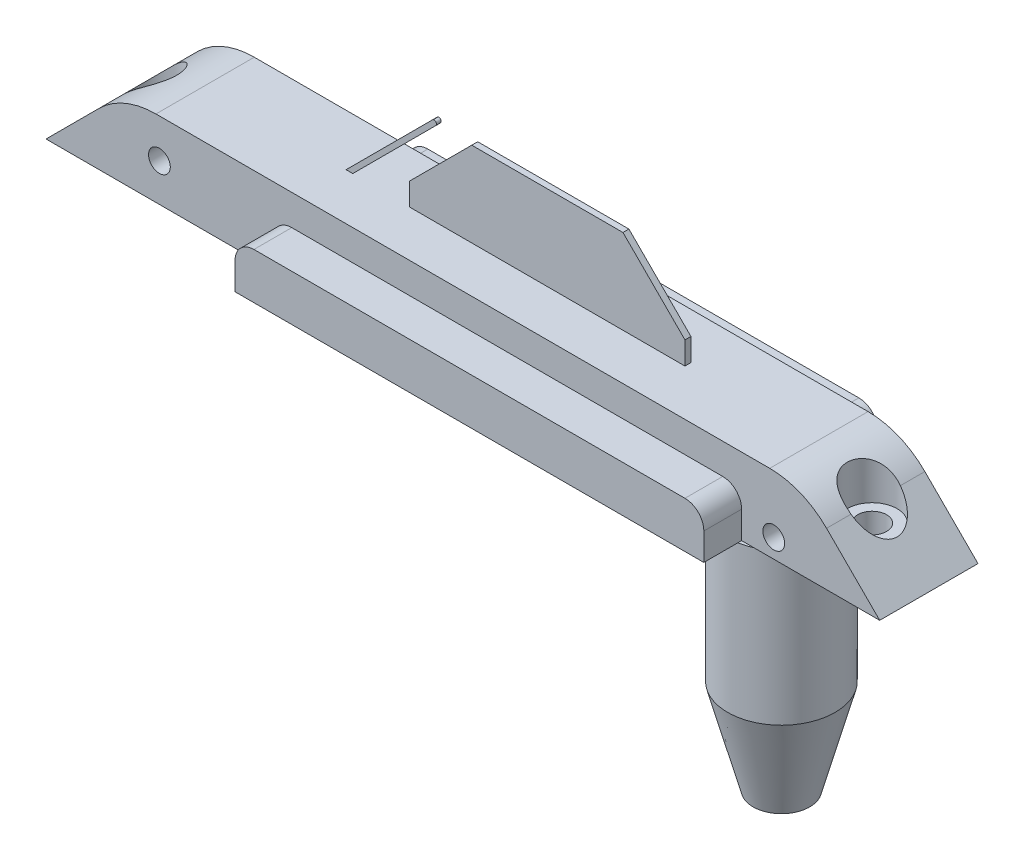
SolidWorks part; units mm, degrees
ref_plane "Front" through (0, 0, 0) normal (0, 0, 1) x (1, 0, 0)
ref_plane "Top" through (0, 0, 0) normal (0, 1, 0) x (1, 0, 0)
ref_plane "Right" through (0, 0, 0) normal (1, 0, 0) x (0, 0, -1)
sketch "Sketch1" plane through (0, 0, 0) normal (0, 1, 0) x (1, 0, 0)
  line L0 (24.765, 0) -> (0, 0) construction
  line L1 (-115.2652, 8.255) -> (24.765, 8.255)
  line L2 (-115.2652, 8.255) -> (-115.2652, -8.255)
  line L3 (-115.2652, -8.255) -> (24.765, -8.255)
  line L4 (24.765, 8.255) -> (24.765, -8.255)
  dimension "D1" = 16.51
  dimension "D2" = 140.0302
  dimension "D3" = 24.765
extrude "Extrude1" add sketch "Sketch1" along normal blind 12.8778
sketch "Sketch2" plane through (0, 0, 0) normal (0, 0, 1) x (1, 0, 0)
  line L0 (-72.7202, 12.8778) -> (-72.1589, 12.3165)
  line L1 (24.765, 12.8778) -> (-115.2652, 12.8778) construction
  line L2 (-58.2156, 27.3824) -> (-72.7202, 12.8778)
  line L7 (-57.6543, 26.8212) -> (-72.1589, 12.3165)
  arc A0 (-58.2156, 27.3824) -> (-57.6543, 26.8212) centre (-57.9349, 27.1018) cw
  dimension "D1" = 45
  dimension "D2" = 42.545
  dimension "D3" = 20.5126
  dimension "D4" = 14.224
  dimension "D5" = 0.7937
extrude "Extrude2" add sketch "Sketch2" along normal mid plane 0.7937
sketch "Sketch7" plane through (0, 0, 0) normal (0, 0, 1) x (1, 0, 0)
  line L0 (11.8872, 12.8778) -> (24.765, 0)
  line L1 (24.765, 0) -> (24.765, 12.8778)
  line L2 (24.765, 12.8778) -> (11.8872, 12.8778)
  line L3 (-102.3874, 12.8778) -> (-115.2652, 12.8778)
  line L4 (-115.2652, 12.8778) -> (-115.2652, 0)
  line L5 (-115.2652, 0) -> (-102.3874, 12.8778)
  line L6 (-115.2652, 0) -> (24.765, 0) construction
  line L7 (-115.2652, 12.8778) -> (-115.2652, 0) construction
  line L8 (-115.2652, 12.8778) -> (24.765, 12.8778) construction
  line L9 (24.765, 12.8778) -> (24.765, 0) construction
  line L10 (-115.2652, 12.8778) -> (24.765, 12.8778) construction
  dimension "D1" = 45
  dimension "D2" = 45
extrude "Extrude5" cut sketch "Sketch7" against normal through all and the other way through all
fillet "Fillet3" radius 13.4937 2 edges at (-102.3874, 12.8778, 0) (11.8872, 12.8778, 0)
hole_wizard "CBORE for #8 Socket Head Cap Screw1" positions "Sketch6" profile "Sketch5" counterbore size "#8" standard "Ansi Inch"
sketch "Sketch6" plane through (0, 12.8778, 0) normal (0, 1, 0) x (-1, 0, 0)
  line L1 (115.2652, -8.255) -> (115.2652, 8.255) construction
  line L2 (-24.765, 8.255) -> (-24.765, -8.255) construction
  point P0 (105.7402, 0)
  point P1 (-15.24, 0)
  dimension "D1" = 9.525
  dimension "D2" = 9.525
sketch "Sketch5" plane through (-105.7402, 12.8778, 0) normal (1, 0, 0) x (0, 0, 1)
  line L0 (0, 0) -> (0, 12.8778)
  line L1 (0, 12.8778) -> (2.4384, 12.8778)
  line L3 (2.4384, 12.8778) -> (2.4384, 7.62)
  line L4 (2.4384, 7.62) -> (4.191, 7.62)
  line L5 (4.191, 7.62) -> (4.191, 0)
  line L7 (4.191, 0) -> (0, 0)
  line L11 (0, -6.35) -> (0, 107.95) construction
  dimension "Thru Hole Dia." = 4.8768
  dimension "Thru Hole Depth" = 12.8778
  dimension "C'Bore Dia." = 8.382
  dimension "C'Bore Depth" = 7.62
sketch "Sketch12" plane through (0, 0, 0) normal (0, 0, 1) x (1, 0, 0)
  line L0 (6.2979, 12.8778) -> (-96.7981, 12.8778) construction
  line L1 (-15.6972, 16.6878) -> (-26.1112, 27.1018)
  line L3 (-51.5112, 27.1018) -> (-26.1112, 27.1018)
  line L4 (-61.9252, 12.8778) -> (-61.9252, 16.6878)
  line L5 (-61.9252, 12.8778) -> (-15.6972, 12.8778)
  line L7 (-15.6972, 16.6878) -> (-15.6972, 12.8778)
  line L8 (-51.5112, 27.1018) -> (-61.9252, 16.6878)
  dimension "D1" = 53.34
  dimension "D2" = 46.228
  dimension "D3" = 45
  dimension "D4" = 45
  dimension "D5" = 3.81
  dimension "D6" = 25.4
  dimension "D7" = 14.224
extrude "Blade" add sketch "Sketch12" along normal mid plane 1
sketch "Sketch13" plane through (0, 0, 0) normal (0, 0, 1) x (1, 0, 0)
  line L0 (-77.1652, 0) -> (-77.1652, 4.572)
  line L1 (-73.9902, 7.747) -> (-1.6002, 7.747)
  line L2 (1.5748, 0) -> (1.5748, 4.572)
  line L3 (1.5748, 0) -> (-77.1652, 0)
  line L4 (24.765, 0) -> (-115.2652, 0) construction
  arc A0 (-77.1652, 4.572) -> (-73.9902, 7.747) centre (-73.9902, 4.572) cw
  arc A1 (-1.6002, 7.747) -> (1.5748, 4.572) centre (-1.6002, 4.572) cw
  dimension "D4" = 3.175
  dimension "D1" = 38.1
  dimension "D2" = 78.74
  dimension "D3" = 7.747
extrude "Extrude9" add sketch "Sketch13" along normal mid plane 29.21
hole_wizard "#27 (0.144) Diameter Hole1" positions "Sketch15" profile "Sketch14" hole size "#27" standard "Ansi Inch"
sketch "Sketch15" plane through (0, 0, -8.255) normal (0, 0, -1) x (-1, 0, 0)
  line L0 (77.1652, 0) -> (115.2652, 0) construction
  line L1 (-24.765, 0) -> (-1.5748, 0) construction
  point P0 (-6.9723, 3.175)
  point P1 (96.2152, 6.35)
  dimension "D1" = 19.05
  dimension "D2" = 103.1875
  dimension "D3" = 6.35
  dimension "D4" = 3.175
sketch "Sketch14" plane through (6.9723, 3.175, -8.255) normal (1, 0, 0) x (0, 1, 0)
  line L0 (0, 0) -> (0, 22.86)
  line L1 (0, 22.86) -> (1.8288, 22.86)
  line L2 (1.8288, 22.86) -> (1.8288, 0)
  line L5 (1.8288, 0) -> (0, 0)
  line L11 (0, -6.35) -> (0, 107.95) construction
  dimension "Thru Hole Dia." = 3.6576
  dimension "Thru Hole Depth" = 22.86
sketch "Sketch10" plane through (0, 0, 0) normal (0, -1, 0) x (1, 0, 0)
  circle A0 centre (0, 0) radius 9.017
  dimension "D1" = 18.034
extrude "Extrude7" add sketch "Sketch10" along normal blind 25.4
sketch "Sketch11" plane through (0, -25.4, 0) normal (0, -1, 0) x (1, 0, 0)
  circle A1 centre (0, 0) radius 9.017
  circle A2 centre (0, 0) radius 9.017
  dimension "D1" = 0
extrude "Extrude8" add sketch "Sketch11" along normal blind 15.875 draft 15
sketch "RoofSketch16" plane through (0, 0, 0) normal (0, 0, 1) x (1, 0, 0)
  line L0 (-107.737, 33.5153) -> (57.5556, 33.5153) construction
  line L1 (-77.1652, 0) -> (-115.2652, 0) construction
  line L2 (6.2979, 12.8778) -> (-96.7981, 12.8778) construction
  dimension "D1" = 20.6375
equation "\"Buoyancy\"=\"SW-Volume\"*(\"SW-Density\"-.037062)"
